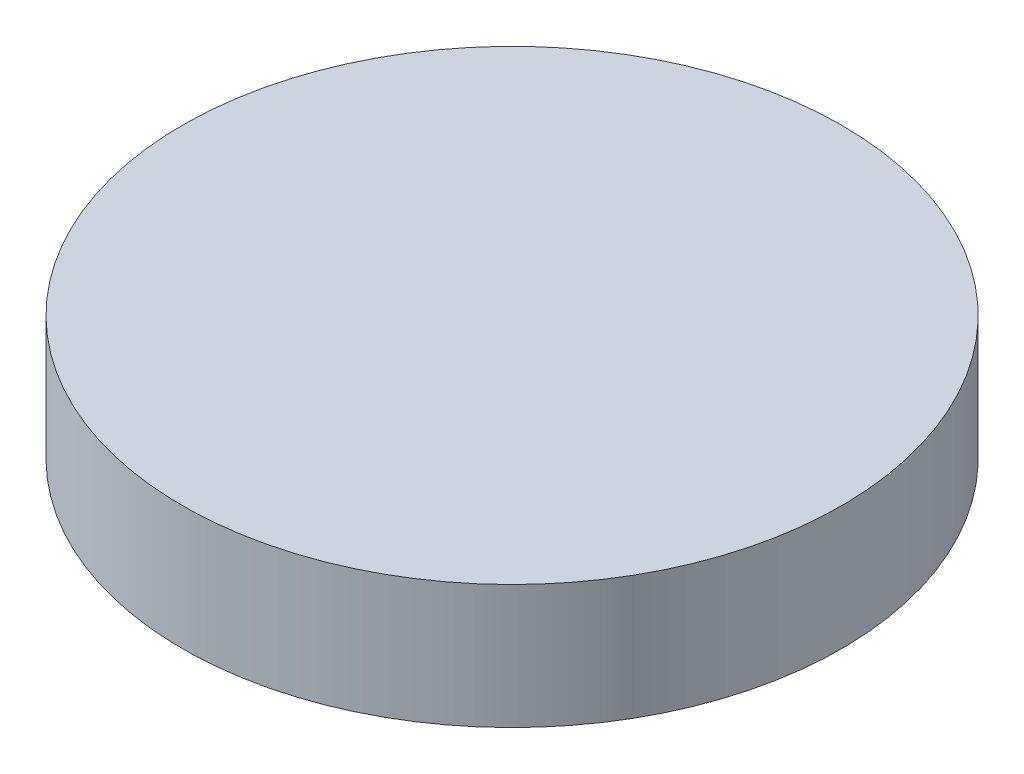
SolidWorks part; units mm, degrees
ref_plane "Front Plane" through (0, 0, 0) normal (0, 0, 1) x (1, 0, 0)
ref_plane "Top Plane" through (0, 0, 0) normal (0, 1, 0) x (1, 0, 0)
ref_plane "Right Plane" through (0, 0, 0) normal (1, 0, 0) x (0, 0, -1)
sketch "Sketch3" plane through (0, 0, 0) normal (0, 1, 0) x (1, 0, 0)
  circle A0 centre (0, 0) radius 50.673
  dimension "D1" = 101.346
extrude "Boss-Extrude1" add sketch "Sketch3" along normal blind 19.05
sketch "Sketch4" plane through (0, 0, 0) normal (0, -1, 0) x (1, 0, 0)
  line L1 (-6.604, 5.588) -> (6.604, 5.588)
  line L2 (-6.604, 5.588) -> (-6.604, -5.588)
  line L3 (-6.604, -5.588) -> (6.604, -5.588)
  line L4 (6.604, 5.588) -> (6.604, -5.588)
  line L5 (-6.604, 5.588) -> (6.604, -5.588) construction
  line L6 (-6.604, -5.588) -> (6.604, 5.588) construction
  point P0 (0, 0)
  dimension "D1" = 11.176
  dimension "D2" = 13.208
extrude "Cut-Extrude1" cut sketch "Sketch4" against normal blind 12.7
